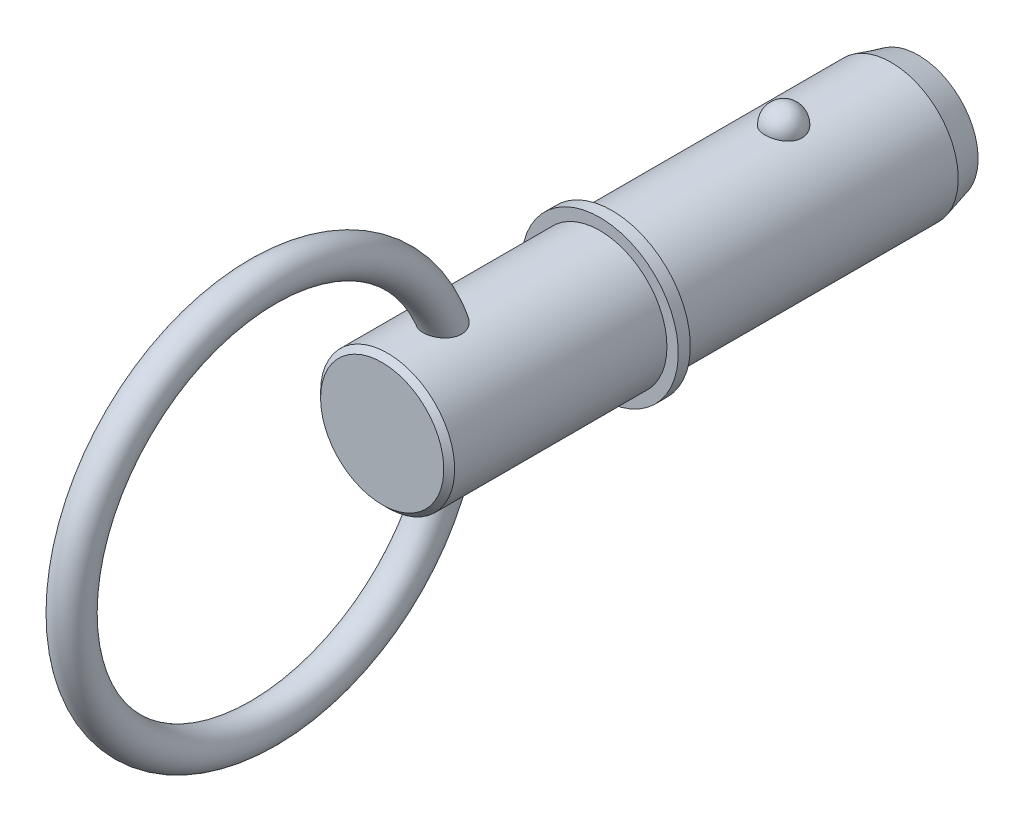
SolidWorks part; units mm, degrees
ref_plane "Front Plane" through (0, 0, 0) normal (0, 0, 1) x (1, 0, 0)
ref_plane "Top Plane" through (0, 0, 0) normal (0, 1, 0) x (1, 0, 0)
ref_plane "Right Plane" through (0, 0, 0) normal (1, 0, 0) x (0, 0, -1)
sketch "Sketch2" plane through (0, 0, 0) normal (0, 0, 1) x (1, 0, 0)
  circle A0 centre (0, 0) radius 11.115
  point P3 (0, 11.115)
  dimension "D1" = 22.23
extrude "Boss-Extrude1" add sketch "Sketch2" along normal blind 25.4
sketch "Sketch3" plane through (0, 0, 0) normal (0, 0, -1) x (-1, 0, 0)
  circle A0 centre (0, 0) radius 11.115
  dimension "D1" = 22.23
extrude "Boss-Extrude2" add sketch "Sketch3" along normal blind 25.4
chamfer "Chamfer1" distance 4.5 angle 15 1 edges at (-11.115, 0, -25.4)
sketch "Sketch18" plane through (0, 0, 0) normal (1, 0, 0) x (0, 0, -1)
  line L0 (20.9, 11.115) -> (-25.4, 11.115) construction
  line L1 (3.07, 14.185) -> (3.07, 8.045)
  line L2 (-25.4, -11.115) -> (20.9, -11.115) construction
  arc A0 (3.07, 14.185) -> (3.07, 8.045) centre (3.07, 11.115) ccw
  point P4 (0, 11.115)
  dimension "D1" = 25.3
revolve "Revolve1" add sketch "Sketch18" angle 360 about L1
sketch "Sketch19" plane through (0, 0, 0) normal (1, 0, 0) x (0, 0, -1)
  line L0 (-33.7288, 0) -> (-46.4542, 0) construction
sketch "Sketch20" plane through (0, 0, 0) normal (1, 0, 0) x (0, 0, -1)
  line L0 (-25.4, 0) -> (-25.4, 13)
  line L1 (-25.4, 11.115) -> (-25.4, -11.115) construction
  line L2 (-25.4, 13) -> (-27.4, 13)
  line L3 (-27.4, 13) -> (-27.4, 0)
  line L4 (-33.7288, 0) -> (-46.4542, 0) construction
  line L5 (-27.4, 0) -> (-25.4, 0)
  dimension "D1" = 13
  dimension "D2" = 2
revolve "Revolve2" add sketch "Sketch20" angle 360 about L0
sketch "Sketch21" plane through (0, 0, 25.4) normal (0, 0, -1) x (-1, 0, 0)
  circle A0 centre (0, 0) radius 11.115
  dimension "D1" = 22.23
extrude "Boss-Extrude3" add sketch "Sketch21" against normal blind 38.1
chamfer "Chamfer2" distance 0.9 angle 45 1 edges at (-11.115, 0, 63.5)
sketch "Sketch23" plane through (0, 0, 0) normal (1, 0, 0) x (0, 0, -1)
  line L0 (-63.5, 10.215) -> (-63.5, -10.215) construction
  circle A0 centre (-83.25, 0) radius 31.75
  point P2 (-51.5, 0)
  dimension "D1" = 63.5
  dimension "D2" = 12
sketch "Sketch24" plane through (0, 0, 0) normal (0, 1, 0) x (1, 0, 0)
  circle A0 centre (0, -51.5) radius 3
  dimension "D1" = 6
sweep "Sweep1" add profiles "Sketch24" path "Sketch23"
